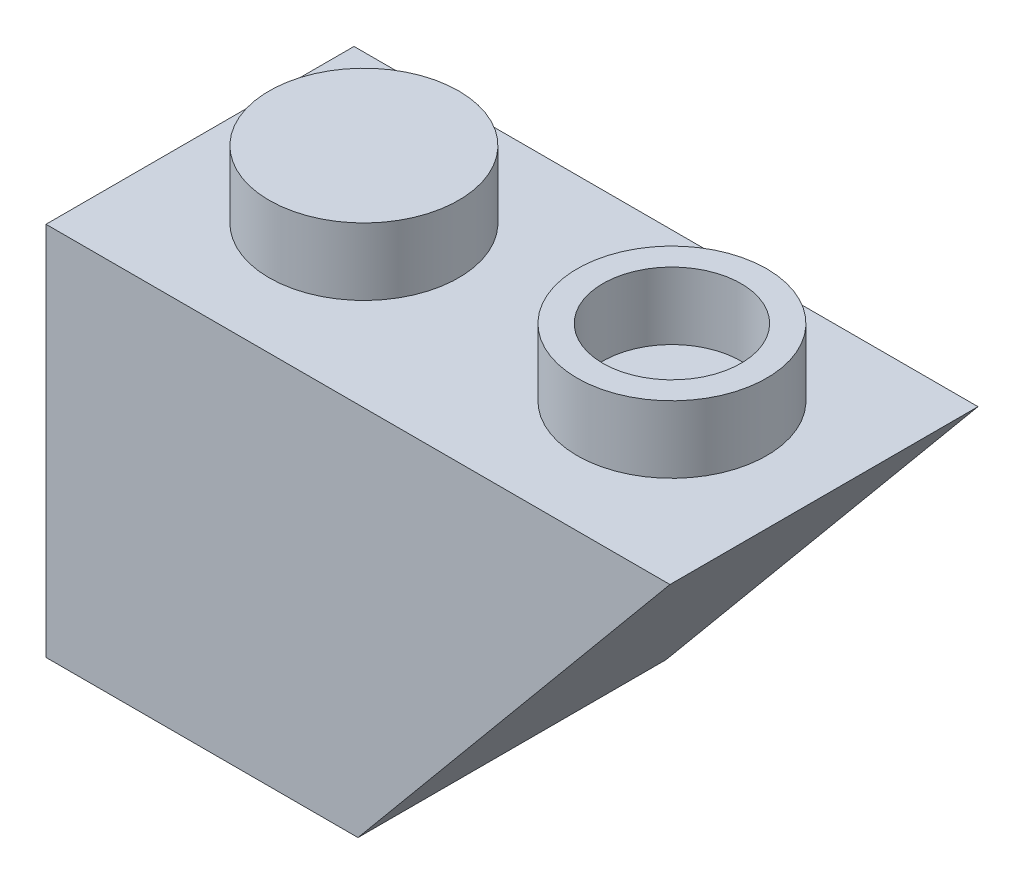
SolidWorks part; units mm, degrees
ref_plane "Front Plane" through (0, 0, 0) normal (0, 0, 1) x (1, 0, 0)
ref_plane "Top Plane" through (0, 0, 0) normal (0, 1, 0) x (1, 0, 0)
ref_plane "Right Plane" through (0, 0, 0) normal (1, 0, 0) x (0, 0, -1)
sketch "Sketch1" plane through (0, 0, 0) normal (0, 1, 0) x (1, 0, 0)
  line L1 (7.9, -3.9) -> (-7.9, -3.9)
  line L2 (7.9, -3.9) -> (7.9, 3.9)
  line L3 (7.9, 3.9) -> (-7.9, 3.9)
  line L4 (-7.9, -3.9) -> (-7.9, 3.9)
  line L5 (7.9, -3.9) -> (-7.9, 3.9) construction
  line L6 (7.9, 3.9) -> (-7.9, -3.9) construction
  point P0 (0, 0)
  dimension "D1" = 15.8
  dimension "D2" = 7.8
extrude "Extrude1" add sketch "Sketch1" along normal blind 9.5
sketch "Sketch2" plane through (0, 0, -3.9) normal (0, 0, -1) x (-1, 0, 0)
  line L0 (-7.9, 9.5) -> (0, 0)
extrude "Extrude2" cut sketch "Sketch2" against normal through all and the other way through all flip side to cut
sketch "Sketch3" plane through (0, 0, 0) normal (0, -1, 0) x (1, 0, 0)
  line L0 (-7.9, -3.9) -> (-7.9, 3.9) construction
  line L1 (-6.4, 2.4) -> (-1.6, 2.4)
  line L2 (-6.4, 2.4) -> (-6.4, -2.4)
  line L3 (-6.4, -2.4) -> (-1.6, -2.4)
  line L4 (-1.6, 2.4) -> (-1.6, -2.4)
  line L5 (-7.9, 3.9) -> (0, 3.9) construction
  dimension "D1" = 4.8
  dimension "D2" = 1.5
  dimension "D3" = 1.5
extrude "Extrude3" cut sketch "Sketch3" against normal blind 6.6
sketch "Sketch4" plane through (0, 9.5, 0) normal (0, 1, 0) x (1, 0, 0)
  line L0 (7.9, 3.9) -> (-7.9, 3.9) construction
  line L1 (-7.9, 3.9) -> (-7.9, -3.9) construction
  circle A0 centre (-3.9, 0.15) radius 2.4
  dimension "D1" = 4.8
  dimension "D2" = 3.75
  dimension "D3" = 4
extrude "Extrude4" add sketch "Sketch4" along normal blind 1.7
sketch "Sketch5" plane through (0, 9.5, 0) normal (0, 1, 0) x (1, 0, 0)
  line L0 (7.9, 3.9) -> (-7.9, 3.9) construction
  line L1 (7.9, -3.9) -> (7.9, 3.9) construction
  circle A0 centre (3.9, 0.15) radius 2.4
  dimension "D1" = 4.8
  dimension "D2" = 3.75
  dimension "D3" = 4
extrude "Extrude5" add sketch "Sketch5" along normal blind 1.7
sketch "Sketch6" plane through (0, 9.5, 0) normal (0, 1, 0) x (1, 0, 0)
  circle A0 centre (3.9, 0.15) radius 1.75
  circle A1 centre (3.9, 0.15) radius 2.4 construction
  dimension "D1" = 3.5
extrude "Extrude7" cut sketch "Sketch6" along normal blind 4
